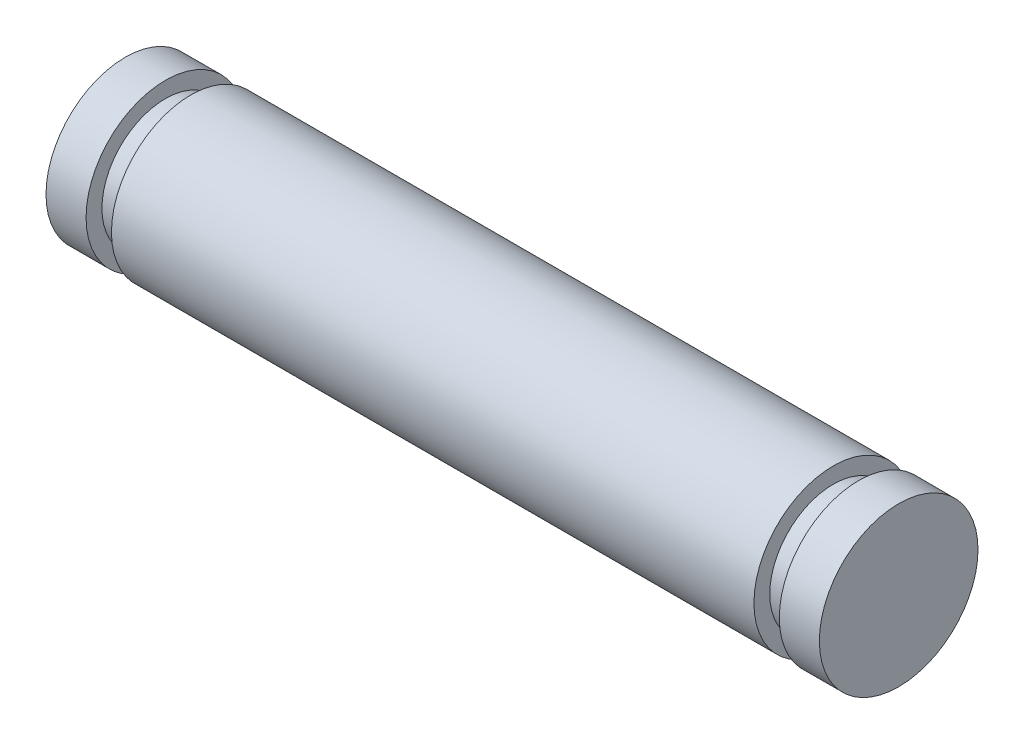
SolidWorks part; units mm, degrees
ref_plane "Front Plane" through (0, 0, 0) normal (0, 0, 1) x (1, 0, 0)
ref_plane "Top Plane" through (0, 0, 0) normal (0, 1, 0) x (1, 0, 0)
ref_plane "Right Plane" through (0, 0, 0) normal (1, 0, 0) x (0, 0, -1)
sketch "Sketch1" plane through (0, 0, 0) normal (1, 0, 0) x (0, 0, -1)
  circle A0 centre (0, 0) radius 2
  dimension "D1" = 4
extrude "Boss-Extrude1" add sketch "Sketch1" along normal mid plane 19.5
ref_axis "Axis1" through (-10.725, 0, 0) along (1, 0, 0)
sketch "Sketch2" plane through (0, 0, 0) normal (0, 1, 0) x (1, 0, 0)
  line L0 (9.75, 2) -> (-9.75, 2) construction
  line L1 (-8.74, 2) -> (-8.1, 2)
  line L2 (-8.74, 2) -> (-8.74, 1.6)
  line L3 (-8.74, 1.6) -> (-8.1, 1.6)
  line L4 (-8.1, 2) -> (-8.1, 1.6)
  line L5 (-10.725, 0) -> (10.725, 0) construction
  dimension "D1" = 0.64
  dimension "D2" = 1.6
  dimension "D3" = 8.1
revolve "Cut-Revolve1" cut sketch "Sketch2" angle 360 about axis through (-10.725, 0, 0) along (1, 0, 0)
mirror "Mirror1" about plane through (0, 0, 0) normal (1, 0, 0) of "Cut-Revolve1"
